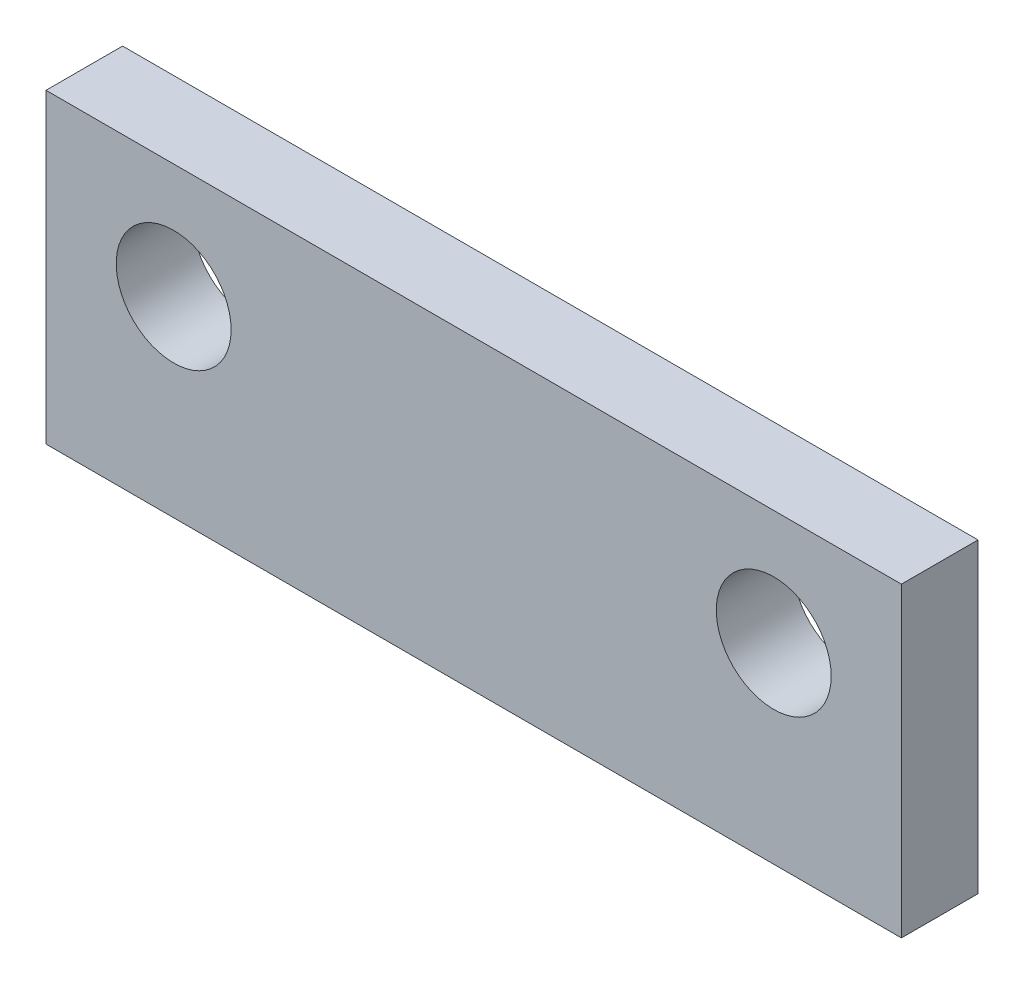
SolidWorks part; units mm, degrees
ref_plane "前视基准面" through (0, 0, 0) normal (0, 0, 1) x (1, 0, 0)
ref_plane "上视基准面" through (0, 0, 0) normal (0, 1, 0) x (1, 0, 0)
ref_plane "右视基准面" through (0, 0, 0) normal (1, 0, 0) x (0, 0, -1)
sketch "草图1" plane through (0, 0, 0) normal (0, 0, 1) x (1, 0, 0)
  line L0 (0, -12) -> (33.5, -12)
  line L1 (0, 0) -> (33.5, 0)
  line L2 (0, -12) -> (0, 0)
  line L3 (33.5, -12) -> (33.5, 0)
  circle A0 centre (5, -4.5) radius 2.25
  circle A1 centre (28.5, -4.5) radius 2.25
extrude "凸台-拉伸1" add sketch "草图1" along normal blind 3
